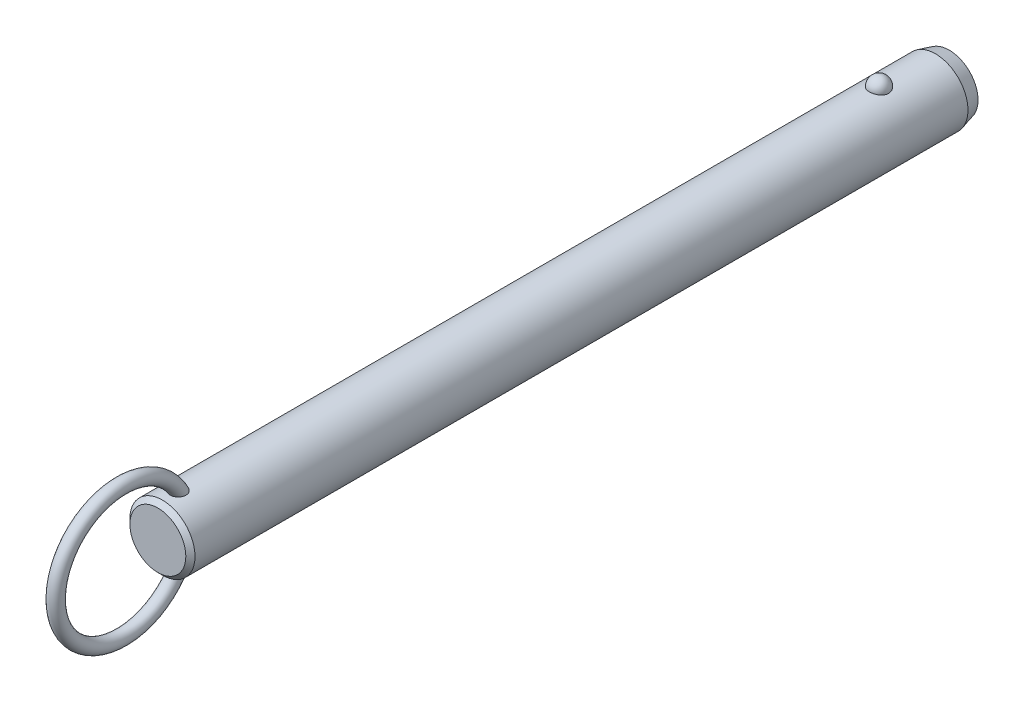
SolidWorks part; units mm, degrees
ref_plane "Front Plane" through (0, 0, 0) normal (0, 0, 1) x (1, 0, 0)
ref_plane "Top Plane" through (0, 0, 0) normal (0, 1, 0) x (1, 0, 0)
ref_plane "Right Plane" through (0, 0, 0) normal (1, 0, 0) x (0, 0, -1)
sketch "Sketch2" plane through (0, 0, 0) normal (0, 0, 1) x (1, 0, 0)
  circle A0 centre (0, 0) radius 7.1
  point P3 (0, 7.1)
  dimension "D1" = 14.2
extrude "Boss-Extrude1" add sketch "Sketch2" along normal blind 147.3
sketch "Sketch3" plane through (0, 0, 0) normal (0, 0, -1) x (-1, 0, 0)
  circle A0 centre (0, 0) radius 7.1
  dimension "D1" = 14.2
extrude "Boss-Extrude2" add sketch "Sketch3" along normal blind 17.4
chamfer "Chamfer1" distance 3 angle 15 1 edges at (-7.1, 0, -17.4)
sketch "Sketch12" plane through (0, 0, 0) normal (1, 0, 0) x (0, 0, -1)
  line L0 (-147.3, 7.1) -> (-147.3, -7.1) construction
  point P0 (-147.3, 0)
sketch "Sketch13" plane through (0, 0, 0) normal (1, 0, 0) x (0, 0, -1)
  circle A0 centre (-163.15, 0) radius 15.85
  point P2 (-147.3, 0)
  dimension "D1" = 31.7
sketch "Sketch14" plane through (0, 0, 0) normal (0, 1, 0) x (1, 0, 0)
  circle A0 centre (0, -148.8) radius 1.5
  point P2 (0, -147.3)
  dimension "D1" = 3
sweep "Sweep1" add profiles "Sketch14" path "Sketch13"
sketch "Sketch15" plane through (0, 0, 147.3) normal (0, 0, 1) x (1, 0, 0)
  circle A0 centre (0, 0) radius 7.1
  dimension "D1" = 14.2
extrude "Boss-Extrude3" add sketch "Sketch15" along normal blind 7.92
chamfer "Chamfer2" distance 1 angle 45 1 edges at (7.1, 0, 155.22)
sketch "Sketch18" plane through (0, 0, 0) normal (1, 0, 0) x (0, 0, -1)
  line L0 (14.4, 7.1) -> (-148.9792, 7.1) construction
  line L1 (2.1, 9.2) -> (2.1, 5)
  line L2 (-148.9792, -7.1) -> (14.4, -7.1) construction
  arc A0 (2.1, 9.2) -> (2.1, 5) centre (2.1, 7.1) ccw
  point P4 (0, 7.1)
  dimension "D1" = 16.3
revolve "Revolve1" add sketch "Sketch18" angle 360 about L1
